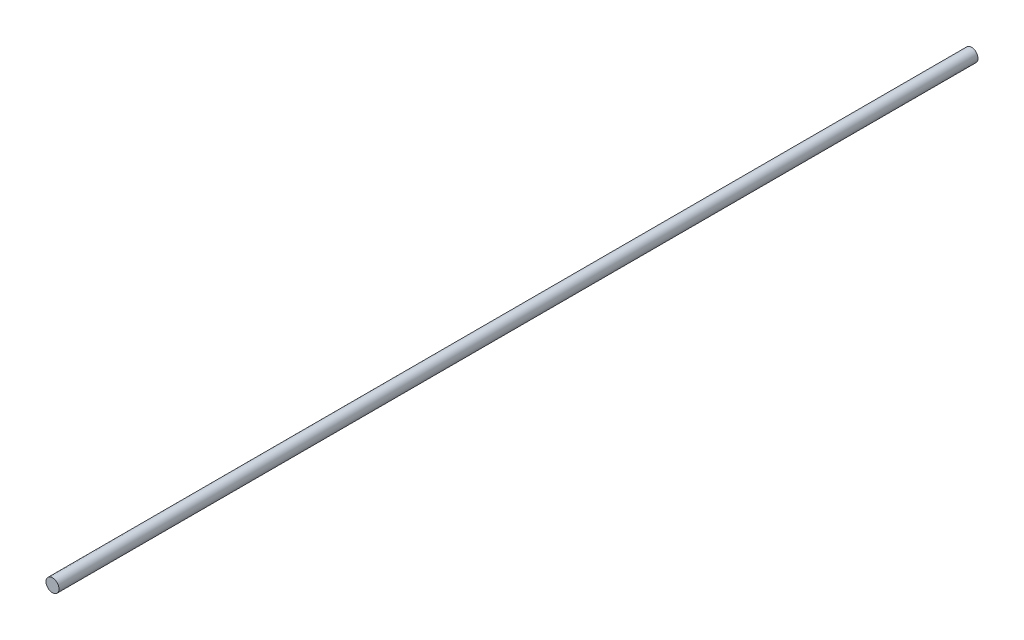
SolidWorks part; units mm, degrees
ref_plane "Front Plane" through (0, 0, 0) normal (0, 0, 1) x (1, 0, 0)
ref_plane "Top Plane" through (0, 0, 0) normal (0, 1, 0) x (1, 0, 0)
ref_plane "Right Plane" through (0, 0, 0) normal (1, 0, 0) x (0, 0, -1)
sketch "Sketch1" plane through (0, 0, 0) normal (0, 0, 1) x (1, 0, 0)
  circle A0 centre (0, 0) radius 30
  dimension "D1" = 60
extrude "Boss-Extrude1" add sketch "Sketch1" against normal blind 4250
